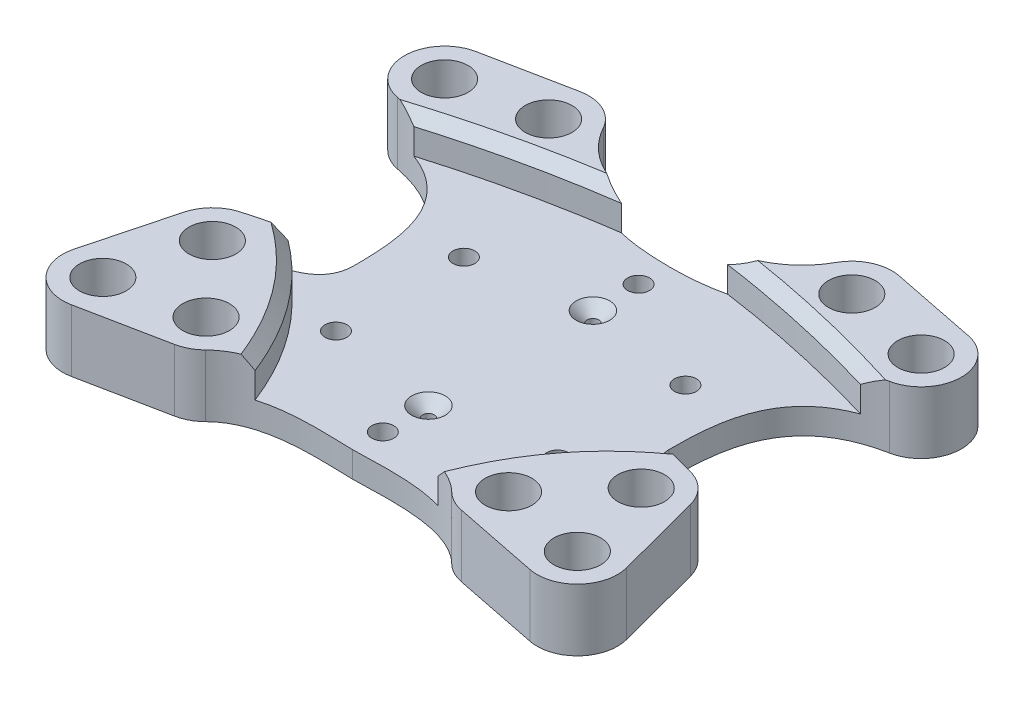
SolidWorks part; units mm, degrees
ref_plane "Спереди" through (0, 0, 0) normal (0, 0, 1) x (1, 0, 0)
ref_plane "Сверху" through (0, 0, 0) normal (0, 1, 0) x (1, 0, 0)
ref_plane "Справа" through (0, 0, 0) normal (1, 0, 0) x (0, 0, -1)
sketch "Sketch1" plane through (0, 0, 0) normal (0, 1, 0) x (1, 0, 0)
  line L0 (-0.5324, 34.9105) -> (-0.5324, -35.0895) construction
  line L1 (0, 35) -> (0, -35) construction
  line L2 (43.6342, 62.6374) -> (67.3542, 57.8934)
  line L3 (39.2198, -52.7491) -> (62.7511, -57.4691)
  line L4 (69.3043, -20.1597) -> (75.5518, -43.8825)
  line L5 (-69.3043, -20.1597) -> (-75.5518, -43.8825)
  line L6 (-39.2198, -52.7491) -> (-62.7511, -57.4691)
  line L7 (-43.6342, 62.6374) -> (-67.3542, 57.8934)
  circle A0 centre (0, 0) radius 35 construction
  circle A1 centre (0, 35) radius 3
  circle A2 centre (30.3109, 17.5) radius 3
  circle A3 centre (30.3109, -17.5) radius 3
  circle A4 centre (0, -35) radius 3
  circle A5 centre (-30.3109, -17.5) radius 3
  circle A6 centre (-30.3109, 17.5) radius 3
  circle A7 centre (65.1969, 47.107) radius 6.4
  circle A8 centre (41.4769, 51.851) radius 6.4
  arc A9 (-69.3043, -20.1597) -> (-62.2597, -12.5643) centre (-58.667, -22.961) cw
  arc A10 (-33.6508, -49.7876) -> (-39.2198, -52.7491) centre (-41.3832, -41.9639) cw
  circle A11 centre (41.3832, -41.9639) radius 6.4
  circle A12 centre (64.9144, -46.6839) radius 6.4
  circle A13 centre (58.667, -22.961) radius 6.4
  arc A14 (-62.7511, -57.4691) -> (-75.5518, -43.8825) centre (-64.9144, -46.6839) cw
  arc A15 (-67.293, 36.3086) -> (-67.3542, 57.8934) centre (-65.1969, 47.107) cw
  arc A16 (-43.6342, 62.6374) -> (-31.8691, 57.2073) centre (-41.4769, 51.851) cw
  arc A18 (43.6342, 62.6374) -> (31.8691, 57.2073) centre (41.4769, 51.851) ccw
  arc A19 (67.293, 36.3086) -> (67.3542, 57.8934) centre (65.1969, 47.107) ccw
  arc A20 (62.7511, -57.4691) -> (75.5518, -43.8825) centre (64.9144, -46.6839) ccw
  arc A21 (33.6508, -49.7876) -> (39.2198, -52.7491) centre (41.3832, -41.9639) ccw
  arc A22 (69.3043, -20.1597) -> (62.2597, -12.5643) centre (58.667, -22.961) ccw
  circle A23 centre (-58.667, -22.961) radius 6.4
  circle A24 centre (-64.9144, -46.6839) radius 6.4
  circle A25 centre (-41.3832, -41.9639) radius 6.4
  circle A26 centre (-41.4769, 51.851) radius 6.4
  circle A27 centre (-65.1969, 47.107) radius 6.4
  arc A28 (-1.947, -43.2853) -> (1.947, -43.2853) centre (0, 0) ccw
  spline S0 degree 3 poles (31.8691, 57.2073) (26.2541, 47.1354) (15.6698, 43.3291) (0, 43.3291) knots 0 0 0 0 1 1 1 1
  spline S1 degree 3 poles (43.3291, 0) (43.3291, 13.4806) (44.1138, 31.8092) (67.293, 36.3086) knots 0 0 0 0 1 1 1 1
  spline S2 degree 3 poles (43.3291, 0) (43.7456, -9.9106) (55.1015, -10.0907) (62.2597, -12.5643) knots 0 0 0 0 1 1 1 1
  spline S3 degree 3 poles (33.6508, -49.7876) (25.5272, -41.7589) (9.7206, -43.1677) (0, -43.3291) knots 0 0 0 0 1 1 1 1
  spline S4 degree 3 poles (-33.6508, -49.7876) (-25.5272, -41.7589) (-9.7206, -43.1677) (0, -43.3291) knots 0 0 0 0 1 1 1 1
  spline S5 degree 3 poles (-43.3291, 0) (-43.7456, -9.9106) (-55.1015, -10.0907) (-62.2597, -12.5643) knots 0 0 0 0 1 1 1 1
  spline S6 degree 3 poles (-43.3291, 0) (-43.3291, 13.4806) (-44.1138, 31.8092) (-67.293, 36.3086) knots 0 0 0 0 1 1 1 1
  spline S7 degree 3 poles (-31.8691, 57.2073) (-26.2541, 47.1354) (-15.6698, 43.3291) (0, 43.3291) knots 0 0 0 0 1 1 1 1
  point P18 (0, 0)
  dimension "D1" = 70
  dimension "D2" = 6
  dimension "D5" = 12.8
  dimension "D6" = 24
  dimension "D4" = 22
  dimension "D9" = 22
  dimension "D7" = 4.72
  dimension "D3" = 6
sketch "Sketch3" plane through (0, 0, 0) normal (0, 1, 0) x (1, 0, 0)
  line L0 (43.6342, 62.6374) -> (67.3542, 57.8934) construction
  line L1 (-43.6342, 62.6374) -> (-67.3542, 57.8934) construction
  line L2 (-69.3043, -20.1597) -> (-75.5518, -43.8825) construction
  line L3 (-39.2198, -52.7491) -> (-62.7511, -57.4691) construction
  line L4 (39.2198, -52.7491) -> (62.7511, -57.4691) construction
  line L5 (69.3043, -20.1597) -> (75.5518, -43.8825) construction
  line L6 (43.6342, 62.6374) -> (67.3542, 57.8934)
  line L7 (-43.6342, 62.6374) -> (-67.3542, 57.8934)
  line L8 (-69.3043, -20.1597) -> (-75.5518, -43.8825)
  line L9 (-39.2198, -52.7491) -> (-62.7511, -57.4691)
  line L10 (39.2198, -52.7491) -> (62.7511, -57.4691)
  line L11 (69.3043, -20.1597) -> (75.5518, -43.8825)
  circle A0 centre (41.4769, 51.851) radius 6.4 construction
  circle A1 centre (65.1969, 47.107) radius 6.4 construction
  circle A2 centre (64.9144, -46.6839) radius 6.4 construction
  circle A3 centre (41.3832, -41.9639) radius 6.4 construction
  circle A4 centre (-64.9144, -46.6839) radius 6.4 construction
  circle A5 centre (-41.3832, -41.9639) radius 6.4 construction
  circle A6 centre (-58.667, -22.961) radius 6.4 construction
  circle A7 centre (-65.1969, 47.107) radius 6.4 construction
  circle A8 centre (-41.4769, 51.851) radius 6.4 construction
  circle A9 centre (-30.3109, 17.5) radius 3 construction
  circle A10 centre (-30.3109, -17.5) radius 3 construction
  circle A11 centre (0, -35) radius 3 construction
  circle A12 centre (30.3109, -17.5) radius 3 construction
  circle A13 centre (30.3109, 17.5) radius 3 construction
  circle A15 centre (0, 35) radius 3 construction
  arc A16 (67.293, 36.3086) -> (67.3542, 57.8934) centre (65.1969, 47.107) ccw construction
  arc A17 (43.6342, 62.6374) -> (31.8691, 57.2073) centre (41.4769, 51.851) ccw construction
  arc A18 (-31.8691, 57.2073) -> (-43.6342, 62.6374) centre (-41.4769, 51.851) ccw construction
  arc A19 (-67.3542, 57.8934) -> (-67.293, 36.3086) centre (-65.1969, 47.107) ccw construction
  arc A20 (-62.2597, -12.5643) -> (-69.3043, -20.1597) centre (-58.667, -22.961) ccw construction
  arc A21 (-75.5518, -43.8825) -> (-62.7511, -57.4691) centre (-64.9144, -46.6839) ccw construction
  arc A22 (-39.2198, -52.7491) -> (-33.6508, -49.7876) centre (-41.3832, -41.9639) ccw construction
  arc A23 (33.6508, -49.7876) -> (39.2198, -52.7491) centre (41.3832, -41.9639) ccw construction
  arc A24 (62.7511, -57.4691) -> (75.5518, -43.8825) centre (64.9144, -46.6839) ccw construction
  arc A25 (69.3043, -20.1597) -> (62.2597, -12.5643) centre (58.667, -22.961) ccw construction
  circle A26 centre (58.667, -22.961) radius 6.4 construction
  circle A27 centre (41.4769, 51.851) radius 6.4
  circle A28 centre (65.1969, 47.107) radius 6.4
  circle A29 centre (64.9144, -46.6839) radius 6.4
  circle A30 centre (41.3832, -41.9639) radius 6.4
  circle A31 centre (-64.9144, -46.6839) radius 6.4
  circle A32 centre (-41.3832, -41.9639) radius 6.4
  circle A33 centre (-58.667, -22.961) radius 6.4
  circle A34 centre (-65.1969, 47.107) radius 6.4
  circle A35 centre (-41.4769, 51.851) radius 6.4
  circle A36 centre (-30.3109, 17.5) radius 3
  circle A37 centre (-30.3109, -17.5) radius 3
  circle A38 centre (0, -35) radius 3
  circle A39 centre (30.3109, -17.5) radius 3
  circle A40 centre (30.3109, 17.5) radius 3
  circle A42 centre (0, 35) radius 3
  arc A43 (67.293, 36.3086) -> (67.3542, 57.8934) centre (65.1969, 47.107) ccw
  arc A44 (43.6342, 62.6374) -> (31.8691, 57.2073) centre (41.4769, 51.851) ccw
  arc A45 (-31.8691, 57.2073) -> (-43.6342, 62.6374) centre (-41.4769, 51.851) ccw
  arc A46 (-67.3542, 57.8934) -> (-67.293, 36.3086) centre (-65.1969, 47.107) ccw
  arc A47 (-62.2597, -12.5643) -> (-69.3043, -20.1597) centre (-58.667, -22.961) ccw
  arc A48 (-75.5518, -43.8825) -> (-62.7511, -57.4691) centre (-64.9144, -46.6839) ccw
  arc A49 (-39.2198, -52.7491) -> (-33.6508, -49.7876) centre (-41.3832, -41.9639) ccw
  arc A50 (33.6508, -49.7876) -> (39.2198, -52.7491) centre (41.3832, -41.9639) ccw
  arc A51 (62.7511, -57.4691) -> (75.5518, -43.8825) centre (64.9144, -46.6839) ccw
  arc A52 (69.3043, -20.1597) -> (62.2597, -12.5643) centre (58.667, -22.961) ccw
  circle A53 centre (58.667, -22.961) radius 6.4
  spline S0 degree 3 poles (-690.3602, 679.4788) (829.3172, -786.2905) (-798.2811, 716.6352) (944.0828, -444.552) knots -3.274789 -3.274789 -3.274789 -3.274789 3.431309 3.431309 3.431309 3.431309 only from (43.3291, 0) to (67.293, 36.3086) construction
  spline S1 degree 3 poles (-251.4744, 1016.2257) (274.522, -706.406) (108.1412, 534.2117) (-981.2969, -149.1289) knots -5.075269 -5.075269 -5.075269 -5.075269 7.497209 7.497209 7.497209 7.497209 only from (31.8691, 57.2073) to (0, 43.3291) construction
  spline S2 degree 3 poles (251.4744, 1016.2257) (-274.522, -706.406) (-108.1412, 534.2117) (981.2969, -149.1289) knots -5.075269 -5.075269 -5.075269 -5.075269 7.497209 7.497209 7.497209 7.497209 only from (-31.8691, 57.2073) to (0, 43.3291) construction
  spline S3 degree 3 poles (690.3602, 679.4788) (-829.3172, -786.2905) (798.2811, 716.6352) (-944.0828, -444.552) knots -3.274789 -3.274789 -3.274789 -3.274789 3.431309 3.431309 3.431309 3.431309 only from (-43.3291, 0) to (-67.293, 36.3086) construction
  spline S4 degree 3 poles (-763.4155, 693.8795) (791.7955, -667.0031) (-920.4833, 627.4551) (697.0589, -663.2685) knots -3.032433 -3.032433 -3.032433 -3.032433 4.549446 4.549446 4.549446 4.549446 only from (-43.3291, 0) to (-62.2597, -12.5643) construction
  spline S5 degree 3 poles (618.0329, -808.2778) (-891.1999, 657.6514) (930.6242, -680.6696) (-817.7439, 532.2416) knots -3.27611 -3.27611 -3.27611 -3.27611 4.667337 4.667337 4.667337 4.667337 only from (-33.6508, -49.7876) to (0, -43.3291) construction
  spline S6 degree 3 poles (-618.0329, -808.2778) (891.1999, 657.6514) (-930.6242, -680.6696) (817.7439, 532.2416) knots -3.27611 -3.27611 -3.27611 -3.27611 4.667337 4.667337 4.667337 4.667337 only from (33.6508, -49.7876) to (0, -43.3291) construction
  spline S7 degree 3 poles (763.4155, 693.8795) (-791.7955, -667.0031) (920.4833, 627.4551) (-697.0589, -663.2685) knots -3.032433 -3.032433 -3.032433 -3.032433 4.549446 4.549446 4.549446 4.549446 only from (43.3291, 0) to (62.2597, -12.5643) construction
  spline S8 degree 3 poles (43.3291, 0) (43.3291, 13.4806) (44.1138, 31.8092) (67.293, 36.3086) knots 0 0 0 0 1 1 1 1
  spline S9 degree 3 poles (31.8691, 57.2073) (26.2541, 47.1354) (15.6698, 43.3291) (0, 43.3291) knots 0 0 0 0 1 1 1 1
  spline S10 degree 3 poles (-31.8691, 57.2073) (-26.2541, 47.1354) (-15.6698, 43.3291) (0, 43.3291) knots 0 0 0 0 1 1 1 1
  spline S11 degree 3 poles (-43.3291, 0) (-43.3291, 13.4806) (-44.1138, 31.8092) (-67.293, 36.3086) knots 0 0 0 0 1 1 1 1
  spline S12 degree 3 poles (-43.3291, 0) (-43.7456, -9.9106) (-55.1015, -10.0907) (-62.2597, -12.5643) knots 0 0 0 0 1 1 1 1
  spline S13 degree 3 poles (-33.6508, -49.7876) (-25.5272, -41.7589) (-9.7206, -43.1677) (0, -43.3291) knots 0 0 0 0 1 1 1 1
  spline S14 degree 3 poles (33.6508, -49.7876) (25.5272, -41.7589) (9.7206, -43.1677) (0, -43.3291) knots 0 0 0 0 1 1 1 1
  spline S15 degree 3 poles (43.3291, 0) (43.7456, -9.9106) (55.1015, -10.0907) (62.2597, -12.5643) knots 0 0 0 0 1 1 1 1
extrude "Boss-Extrude1" add sketch "Sketch3" along normal blind 7
sketch "Sketch4" plane through (0, 7, 0) normal (0, 1, 0) x (1, 0, 0)
  line L0 (266.6667, 600) -> (1333.3333, 600) construction
  line L1 (-43.7593, 7.3436) -> (42.2302, 6.0038) construction
  line L2 (43.6342, 62.6374) -> (67.3542, 57.8934) construction
  line L3 (39.2198, -52.7491) -> (62.7511, -57.4691) construction
  line L4 (69.3043, -20.1597) -> (75.5518, -43.8825) construction
  line L5 (43.6342, 62.6374) -> (67.3542, 57.8934)
  line L6 (39.2198, -52.7491) -> (62.7511, -57.4691)
  line L7 (69.3043, -20.1597) -> (75.5518, -43.8825)
  line L8 (0, 43.3291) -> (0, -43.3291) construction
  line L9 (-69.3043, -20.1597) -> (-75.5518, -43.8825)
  line L10 (-39.2198, -52.7491) -> (-62.7511, -57.4691)
  line L11 (-43.6342, 62.6374) -> (-67.3542, 57.8934)
  circle A0 centre (65.1969, 47.107) radius 6.4 construction
  circle A1 centre (41.4769, 51.851) radius 6.4 construction
  arc A2 (43.6342, 62.6374) -> (31.8691, 57.2073) centre (41.4769, 51.851) ccw construction
  arc A3 (67.293, 36.3086) -> (67.3542, 57.8934) centre (65.1969, 47.107) ccw construction
  circle A4 centre (58.667, -22.961) radius 6.4 construction
  circle A5 centre (64.9144, -46.6839) radius 6.4 construction
  circle A6 centre (41.3832, -41.9639) radius 6.4 construction
  arc A7 (33.6508, -49.7876) -> (39.2198, -52.7491) centre (41.3832, -41.9639) ccw construction
  arc A8 (62.7511, -57.4691) -> (75.5518, -43.8825) centre (64.9144, -46.6839) ccw construction
  arc A9 (69.3043, -20.1597) -> (62.2597, -12.5643) centre (58.667, -22.961) ccw construction
  circle A10 centre (65.1969, 47.107) radius 6.4
  circle A11 centre (41.4769, 51.851) radius 6.4
  arc A12 (43.6342, 62.6374) -> (31.8691, 57.2073) centre (41.4769, 51.851) ccw
  arc A13 (67.293, 36.3086) -> (67.3542, 57.8934) centre (65.1969, 47.107) ccw
  circle A14 centre (58.667, -22.961) radius 6.4
  circle A15 centre (64.9144, -46.6839) radius 6.4
  circle A16 centre (41.3832, -41.9639) radius 6.4
  arc A17 (33.6508, -49.7876) -> (39.2198, -52.7491) centre (41.3832, -41.9639) ccw
  arc A18 (62.7511, -57.4691) -> (75.5518, -43.8825) centre (64.9144, -46.6839) ccw
  arc A19 (69.3043, -20.1597) -> (62.2597, -12.5643) centre (58.667, -22.961) ccw
  arc A20 (-69.3043, -20.1597) -> (-62.2597, -12.5643) centre (-58.667, -22.961) cw
  arc A21 (-62.7511, -57.4691) -> (-75.5518, -43.8825) centre (-64.9144, -46.6839) cw
  arc A22 (-33.6508, -49.7876) -> (-39.2198, -52.7491) centre (-41.3832, -41.9639) cw
  circle A23 centre (-41.3832, -41.9639) radius 6.4
  circle A24 centre (-64.9144, -46.6839) radius 6.4
  circle A25 centre (-58.667, -22.961) radius 6.4
  arc A26 (-67.293, 36.3086) -> (-67.3542, 57.8934) centre (-65.1969, 47.107) cw
  arc A27 (-43.6342, 62.6374) -> (-31.8691, 57.2073) centre (-41.4769, 51.851) cw
  circle A28 centre (-41.4769, 51.851) radius 6.4
  circle A29 centre (-65.1969, 47.107) radius 6.4
  spline S0 degree 2 poles (14.5334, 44.8197) (38.268, 41.4637) (61.0919, 34.6007) knots 0 0 0 1 1 1
  spline S1 degree 3 poles (-526.0332, 1977.7281) (445.4647, -1639.2893) (229.8321, 1373.2795) (-1731.1356, -810.7237) knots -6.914408 -6.914408 -6.914408 -6.914408 9.964662 9.964662 9.964662 9.964662 only from (31.8691, 57.2073) to (0, 43.3291) construction
  spline S2 degree 3 poles (-1412.222, 1371.4124) (1583.397, -1484.729) (-1585.6633, 1374.6532) (1765.87, -1014.2431) knots -4.105357 -4.105357 -4.105357 -4.105357 4.267661 4.267661 4.267661 4.267661 only from (43.3291, 0) to (67.293, 36.3086) construction
  spline S3 degree 2 poles (25.0154, -44.9337) (33.6569, -22.8663) (51.4152, -9.5189) knots 0 0 0 1 1 1
  spline S4 degree 3 poles (-1346.4747, -1493.3472) (1698.1907, 1304.7226) (-1767.5409, -1290.3669) (1637.2298, 1105.1814) knots -4.261308 -4.261308 -4.261308 -4.261308 5.643853 5.643853 5.643853 5.643853 only from (33.6508, -49.7876) to (0, -43.3291) construction
  spline S5 degree 3 poles (1521.2963, 1346.2573) (-1589.9339, -1301.1928) (1727.0633, 1251.388) (-1480.3757, -1284.8479) knots -3.98896 -3.98896 -3.98896 -3.98896 5.504858 5.504858 5.504858 5.504858 only from (43.3291, 0) to (62.2597, -12.5643) construction
  spline S6 degree 3 poles (31.8691, 57.2073) (28.2107, 50.6451) (22.4429, 46.7426) (14.5334, 44.8197) knots 0 0 0 0 0.651537 0.651537 0.651537 0.651537
  spline S7 degree 3 poles (61.0919, 34.6007) (62.9566, 35.2916) (65.0168, 35.8668) (67.293, 36.3086) knots 0.901801 0.901801 0.901801 0.901801 1 1 1 1
  spline S8 degree 3 poles (33.6508, -49.7876) (31.3032, -47.4675) (28.314, -45.9354) (25.0154, -44.9337) knots 0 0 0 0 0.288985 0.288985 0.288985 0.288985
  spline S9 degree 3 poles (51.4152, -9.5189) (54.9595, -10.8012) (59.0354, -11.4501) (62.2597, -12.5643) knots 0.54957 0.54957 0.54957 0.54957 1 1 1 1
  spline S10 degree 3 poles (-51.4152, -9.5189) (-54.9595, -10.8012) (-59.0354, -11.4501) (-62.2597, -12.5643) knots 0.54957 0.54957 0.54957 0.54957 1 1 1 1
  spline S11 degree 3 poles (-33.6508, -49.7876) (-31.3032, -47.4675) (-28.314, -45.9354) (-25.0154, -44.9337) knots 0 0 0 0 0.288985 0.288985 0.288985 0.288985
  spline S12 degree 3 poles (-61.0919, 34.6007) (-62.9566, 35.2916) (-65.0168, 35.8668) (-67.293, 36.3086) knots 0.901801 0.901801 0.901801 0.901801 1 1 1 1
  spline S13 degree 3 poles (-31.8691, 57.2073) (-28.2107, 50.6451) (-22.4429, 46.7426) (-14.5334, 44.8197) knots 0 0 0 0 0.651537 0.651537 0.651537 0.651537
  spline S14 degree 2 poles (-25.0154, -44.9337) (-33.6569, -22.8663) (-51.4152, -9.5189) knots 0 0 0 1 1 1
  spline S15 degree 2 poles (-14.5334, 44.8197) (-38.268, 41.4637) (-61.0919, 34.6007) knots 0 0 0 1 1 1
  dimension "D1" = 86
extrude "Boss-Extrude2" add sketch "Sketch4" along normal blind 10
chamfer "Chamfer1" distance 3 angle 45 4 edges
sketch "Sketch5" plane through (0, 7, 0) normal (0, 1, 0) x (1, 0, 0)
  line L0 (0, 22.5) -> (0, -22.5) construction
  line L1 (0, 35) -> (0, -35) construction
  circle A0 centre (0, 22.5) radius 1.6
  circle A1 centre (0, -22.5) radius 1.6
  point P6 (0, 0)
  dimension "D2" = 3.2
  dimension "D1" = 45
extrude "Cut-Extrude1" cut sketch "Sketch5" against normal through all
chamfer "Chamfer2" distance 3 angle 45 2 edges at (0, 7, -20.9) (0, 7, 24.1)
